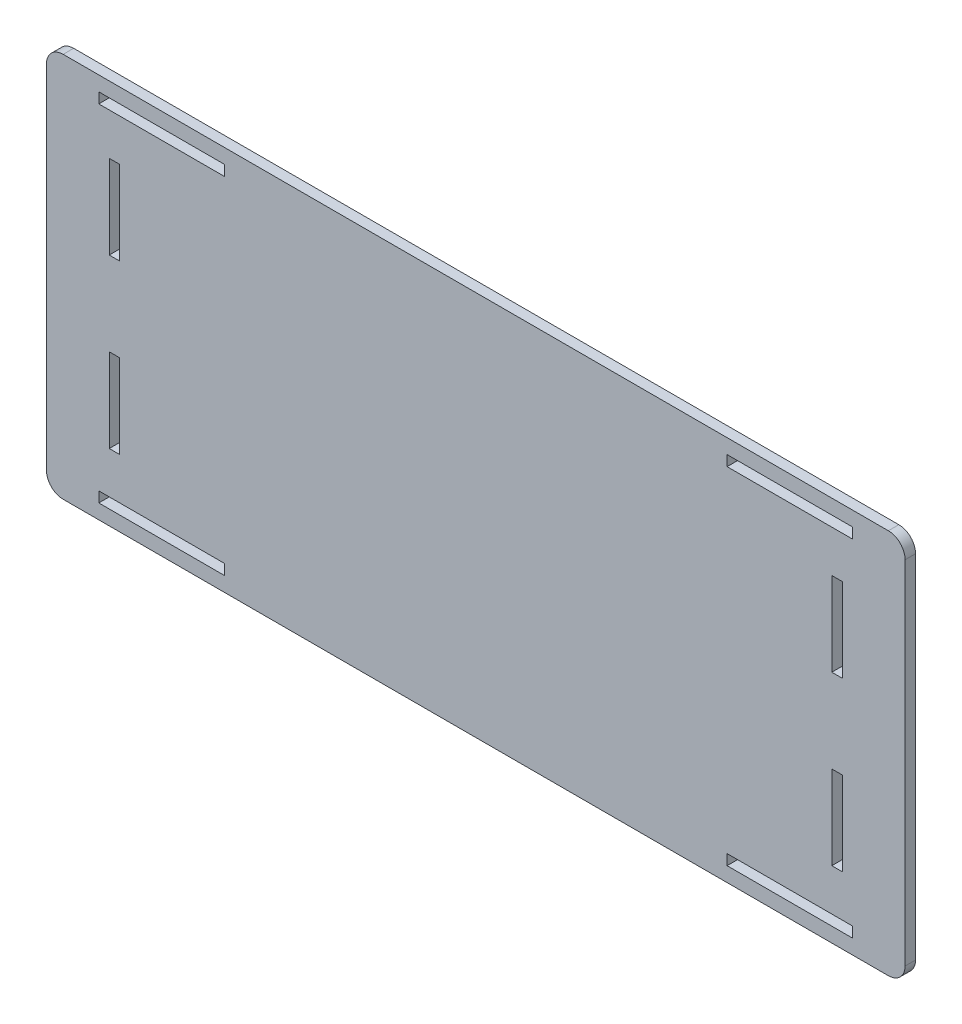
SolidWorks part; units mm, degrees
ref_plane "Front Plane" through (0, 0, 0) normal (0, 0, 1) x (1, 0, 0)
ref_plane "Top Plane" through (0, 0, 0) normal (0, 1, 0) x (1, 0, 0)
ref_plane "Right Plane" through (0, 0, 0) normal (1, 0, 0) x (0, 0, -1)
sketch "Sketch1" plane through (0, 0, 0) normal (0, 0, 1) x (1, 0, 0)
  line L0 (0, 0) -> (25.4, 0)
  line L1 (-130.175, 58.42) -> (130.175, 58.42)
  line L2 (-130.175, 58.42) -> (-130.175, -58.42)
  line L3 (-130.175, -58.42) -> (130.175, -58.42)
  line L4 (130.175, 58.42) -> (130.175, -58.42)
  line L5 (-130.175, 58.42) -> (130.175, -58.42) construction
  line L6 (-130.175, -58.42) -> (130.175, 58.42) construction
  line L7 (76.2, -50.8) -> (114.3, -50.8)
  line L8 (76.2, -50.8) -> (76.2, -53.975)
  line L9 (76.2, -53.975) -> (114.3, -53.975)
  line L10 (114.3, -50.8) -> (114.3, -53.975)
  line L11 (107.95, -12.7) -> (111.125, -12.7)
  line L12 (107.95, -12.7) -> (107.95, -38.1)
  line L13 (107.95, -38.1) -> (111.125, -38.1)
  line L14 (111.125, -12.7) -> (111.125, -38.1)
  line L15 (0, 0) -> (0, -25.4)
  line L16 (111.125, 12.7) -> (111.125, 38.1)
  line L17 (107.95, 38.1) -> (111.125, 38.1)
  line L18 (107.95, 12.7) -> (107.95, 38.1)
  line L19 (107.95, 12.7) -> (111.125, 12.7)
  line L20 (114.3, 50.8) -> (114.3, 53.975)
  line L21 (76.2, 53.975) -> (114.3, 53.975)
  line L22 (76.2, 50.8) -> (76.2, 53.975)
  line L23 (76.2, 50.8) -> (114.3, 50.8)
  line L24 (-76.2, 50.8) -> (-114.3, 50.8)
  line L25 (-76.2, 50.8) -> (-76.2, 53.975)
  line L26 (-76.2, 53.975) -> (-114.3, 53.975)
  line L27 (-114.3, 50.8) -> (-114.3, 53.975)
  line L28 (-107.95, 12.7) -> (-111.125, 12.7)
  line L29 (-107.95, 12.7) -> (-107.95, 38.1)
  line L30 (-107.95, 38.1) -> (-111.125, 38.1)
  line L31 (-111.125, 12.7) -> (-111.125, 38.1)
  line L32 (-111.125, -12.7) -> (-111.125, -38.1)
  line L33 (-107.95, -38.1) -> (-111.125, -38.1)
  line L34 (-107.95, -12.7) -> (-107.95, -38.1)
  line L35 (-107.95, -12.7) -> (-111.125, -12.7)
  line L36 (-114.3, -50.8) -> (-114.3, -53.975)
  line L37 (-76.2, -53.975) -> (-114.3, -53.975)
  line L38 (-76.2, -50.8) -> (-76.2, -53.975)
  line L39 (-76.2, -50.8) -> (-114.3, -50.8)
  point P0 (0, 0)
  dimension "D1" = 260.35
  dimension "D2" = 116.84
  dimension "D3" = 76.2
  dimension "D4" = 114.3
  dimension "D5" = 3.175
  dimension "D6" = 50.8
  dimension "D7" = 3.175
  dimension "D8" = 25.4
  dimension "D9" = 12.7
  dimension "D10" = 107.95
  dimension "D11" = 25.4
  dimension "D12" = 25.4
extrude "Boss-Extrude1" add sketch "Sketch1" along normal blind 3.175
fillet "Fillet1" radius 5.08 4 edges at (130.175, -58.42, 1.5875) (-130.175, -58.42, 1.5875) (130.175, 58.42, 1.5875) (-130.175, 58.42, 1.5875)
